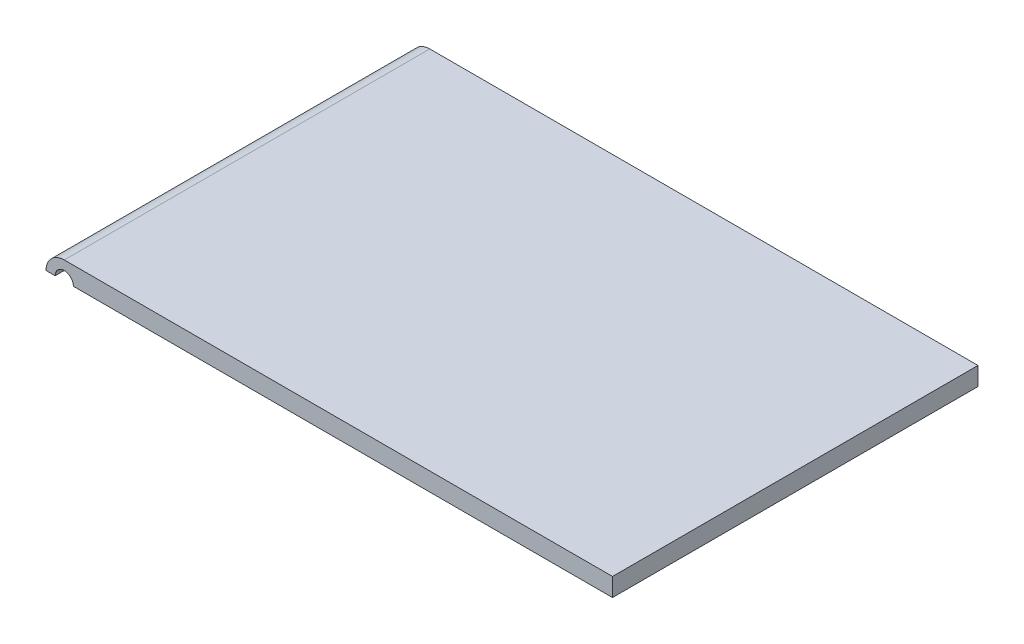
SolidWorks part; units mm, degrees
ref_plane "Plan de face" through (0, 0, 0) normal (0, 0, 1) x (1, 0, 0)
ref_plane "Plan de dessus" through (0, 0, 0) normal (0, 1, 0) x (1, 0, 0)
ref_plane "Plan de droite" through (0, 0, 0) normal (1, 0, 0) x (0, 0, -1)
sketch "Esquisse1" plane through (0, 0, 0) normal (0, 0, 1) x (1, 0, 0)
  line L1 (0, 0) -> (150, 0)
  line L2 (0, 0) -> (0, -5)
  line L3 (0, -5) -> (150, -5)
  line L4 (150, 0) -> (150, -5)
  dimension "D1" = 5
  dimension "D2" = 150
extrude "Boss.-Extru.1" add sketch "Esquisse1" along normal mid plane 100
sketch "Esquisse2" plane through (0, 0, 50) normal (0, 0, 1) x (1, 0, 0)
  line L0 (150, 0) -> (0, 0) construction
  line L1 (0, -5) -> (-5, -5)
  line L2 (0, -5) -> (0, 0)
  arc A0 (0, 0) -> (-5, -5) centre (0, -5) ccw
extrude "Boss.-Extru.2" add sketch "Esquisse2" against normal up to surface (100 mm away)
sketch "Esquisse3" plane through (0, 0, 50) normal (0, 0, 1) x (1, 0, 0)
  circle A0 centre (0, -5) radius 2.5
  arc A1 (0, 0) -> (-5, -5) centre (0, -5) ccw construction
  dimension "D1" = 5
extrude "Enlèv. mat.-Extru.1" cut sketch "Esquisse3" against normal through all
